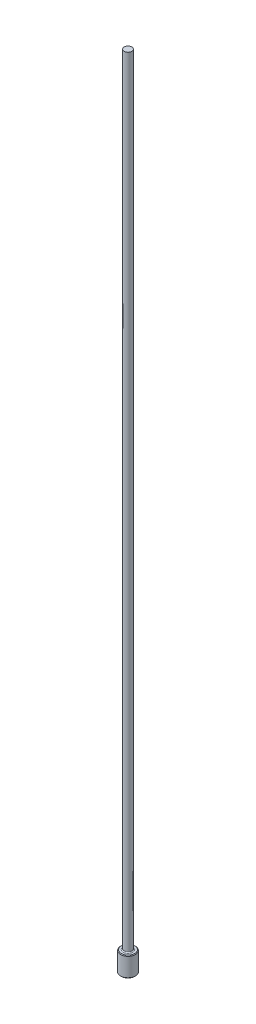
SolidWorks part; units mm, degrees
ref_plane "Front Plane" through (0, 0, 0) normal (0, 0, 1) x (1, 0, 0)
ref_plane "Top Plane" through (0, 0, 0) normal (0, 1, 0) x (1, 0, 0)
ref_plane "Right Plane" through (0, 0, 0) normal (1, 0, 0) x (0, 0, -1)
other "Configuration Table"
sketch "Sketch1" plane through (0, 0, 0) normal (0, 0, 1) x (1, 0, 0)
  line L0 (0, 259.9588) -> (0, -15.1925) construction
  line L1 (0, 0) -> (-0.5842, 0)
  line L2 (-0.5842, 0) -> (-0.5842, 1.5748)
  line L3 (-0.5842, 1.5748) -> (-0.3048, 1.5748)
  line L4 (-0.3048, 1.5748) -> (-0.3048, 63.5)
  line L5 (-0.3048, 63.5) -> (0, 63.5)
  line L6 (0, 63.5) -> (0, 0)
  dimension "L" = 63.5
  dimension "H" = 1.1684
  dimension "T" = 1.5748
  dimension "D" = 0.6096
revolve "Revolve1" add sketch "Sketch1" angle 360 about L0
chamfer "Chamfer1" distance 0.0508 angle 45 2 edges at (0, 1.5748, 0.5842) (0, 0, 0.5842)
fillet "Fillet1" radius 0.0762 1 edges at (0, 1.5748, 0.3048)
